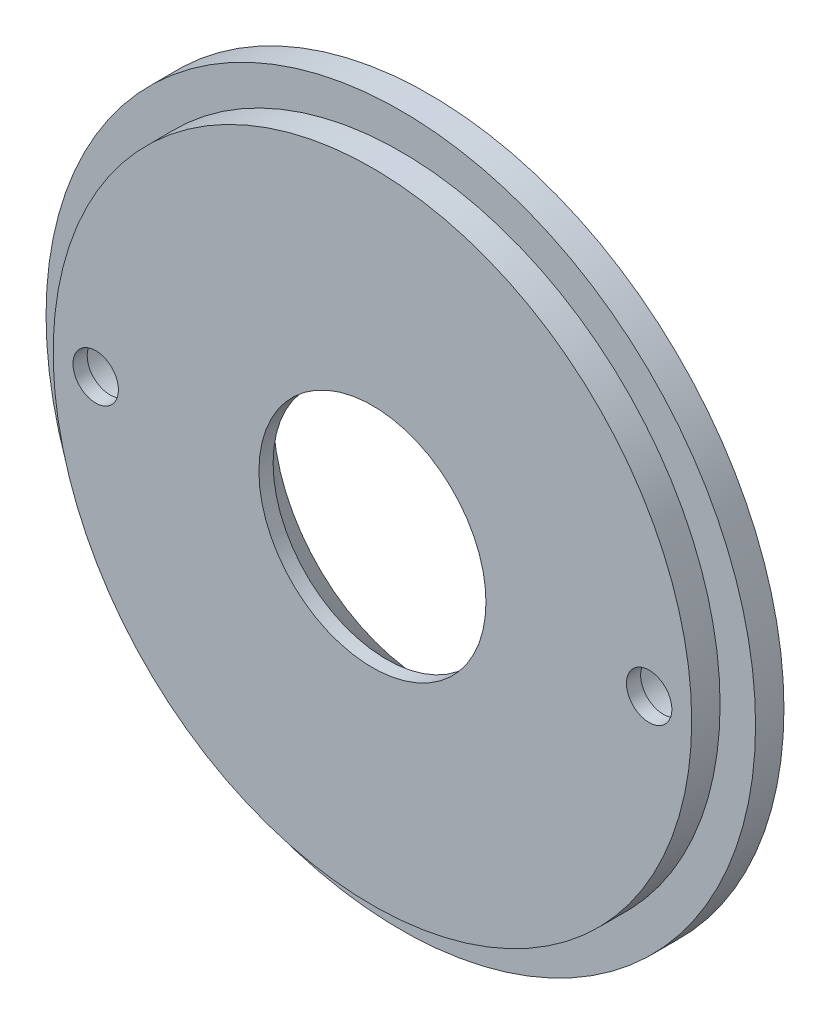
SolidWorks part; units mm, degrees
ref_plane "Face" through (0, 0, 0) normal (0, 0, 1) x (1, 0, 0)
ref_plane "Dessus" through (0, 0, 0) normal (0, 1, 0) x (1, 0, 0)
ref_plane "Droite" through (0, 0, 0) normal (1, 0, 0) x (0, 0, -1)
sketch "Esquisse1" plane through (0, 0, 0) normal (0, 0, 1) x (1, 0, 0)
  circle A0 centre (0, 0) radius 45
  dimension "D1" = 90
extrude "Base-Extrusion" add sketch "Esquisse1" against normal blind 4
sketch "Esquisse2" plane through (0, 0, -4) normal (0, 0, -1) x (-1, 0, 0)
  circle A0 centre (0, 0) radius 50
  dimension "D1" = 100
extrude "Boss.-Extru.1" add sketch "Esquisse2" along normal blind 4
sketch "Esquisse3" plane through (0, 0, -8) normal (0, 0, -1) x (-1, 0, 0)
  circle A0 centre (0, 0) radius 16
  dimension "D1" = 32
extrude "Enlèv. mat.-Extru.1" cut sketch "Esquisse3" against normal blind 14
hole_wizard "Chambrage pour vis à tête cylindrique à 6 pans creux (ou vis CHC) M61" positions "Esquisse3D2" profile "Esquisse6" counterbore size "M6" standard "Ansi Métrique"
sketch3d "Esquisse3D2"
  point P4 (39, 0, -8)
  point P6 (-39, 0, -8)
sketch "Esquisse6" plane through (39, 0, -8) normal (1, 0, 0) x (0, 1, 0)
  line L0 (0, 0) -> (0, 8)
  line L1 (0, 8) -> (3.2, 8)
  line L3 (3.2, 8) -> (3.2, 6)
  line L4 (3.2, 6) -> (5.5, 6)
  line L5 (5.5, 6) -> (5.5, 0)
  line L7 (5.5, 0) -> (0, 0)
  line L11 (0, -6.35) -> (0, 107.95) construction
  dimension "Diamètre du perçage jusqu'au prochain" = 6.4
  dimension "Profondeur du perçage jusqu'au prochain" = 8
  dimension "Diamètre du chambrage" = 11
  dimension "Profondeur du chambrage" = 6
chamfer "Chanfrein1" distance 6 angle 45 1 edges at (-16, 0, -8)
